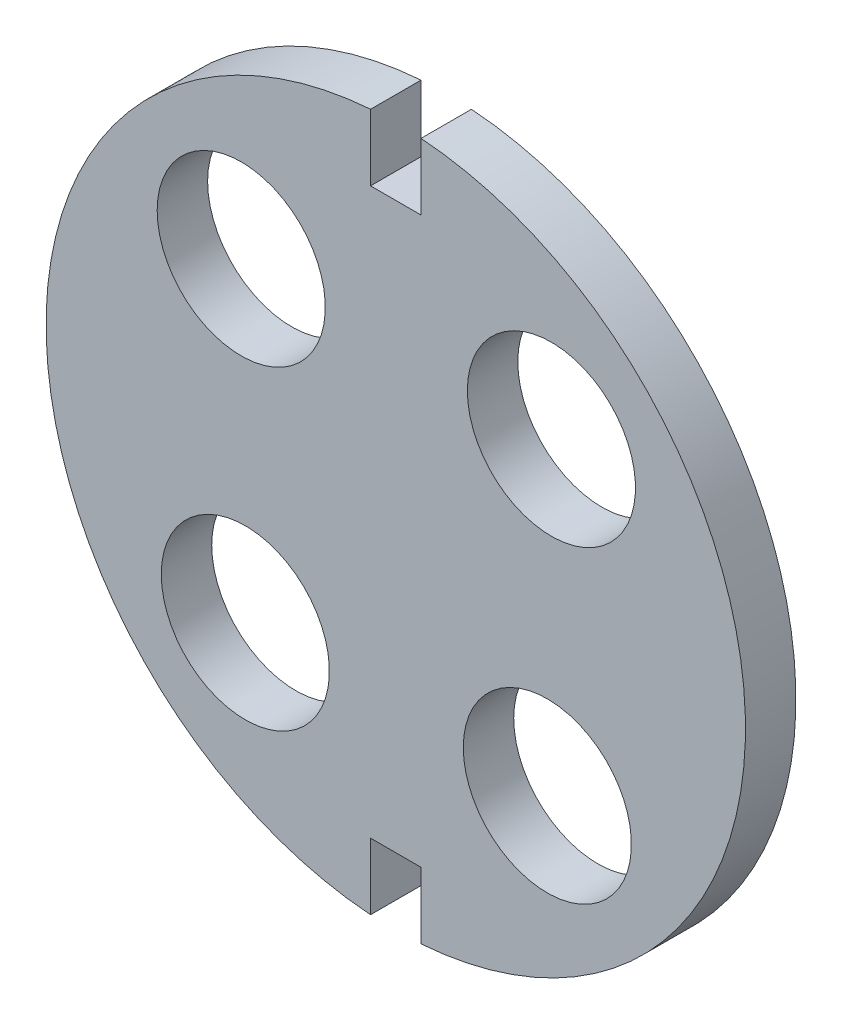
SolidWorks part; units mm, degrees
ref_plane "Front Plane" through (0, 0, 0) normal (0, 0, 1) x (1, 0, 0)
ref_plane "Top Plane" through (0, 0, 0) normal (0, 1, 0) x (1, 0, 0)
ref_plane "Right Plane" through (0, 0, 0) normal (1, 0, 0) x (0, 0, -1)
sketch "Sketch1" plane through (0, 0, 0) normal (0, 0, 1) x (1, 0, 0)
  circle A0 centre (0, 0) radius 26.416
  dimension "D1" = 52.832
extrude "Extrude1" add sketch "Sketch1" along normal blind 3.81
sketch "Sketch2" plane through (0, 0, 0) normal (0, 0, 1) x (1, 0, 0)
  line L0 (0, 0) -> (0, 27.8395) construction
  line L1 (0, 0) -> (0, -28.8472) construction
  line L2 (0, 0) -> (-23.3487, 23.3487) construction
  line L3 (0, 0) -> (-29.645, 0) construction
  line L4 (0, 0) -> (31.2407, 0) construction
  circle A0 centre (-11.6743, 11.6743) radius 6.35
  circle A1 centre (11.7569, 11.5912) radius 6.35
  circle A2 centre (11.4489, -11.8955) radius 6.35
  circle A3 centre (-11.3643, -11.9764) radius 6.35
  dimension "D2" = 12.7
  dimension "D4" = 12.7
  dimension "D5" = 12.7
  dimension "D6" = 12.7
  dimension "D1" = 45
  dimension "D3" = 16.51
  dimension "D7" = 16.51
  dimension "D8" = 16.51
  dimension "D9" = 16.51
extrude "Cut-Extrude1" cut sketch "Sketch2" along normal through all
sketch "Sketch3" plane through (0, 0, 0) normal (0, 0, 1) x (1, 0, 0)
  line L0 (0, 0) -> (0, 27.4196) construction
  line L1 (0, 0) -> (0, -27.9234) construction
  line L2 (-30.4848, 0) -> (29.645, 0) construction
  line L4 (-1.905, 27.4196) -> (1.905, 27.4196)
  line L5 (-1.905, 27.4196) -> (-1.905, 21.336)
  line L6 (-1.905, 21.336) -> (1.905, 21.336)
  line L7 (1.905, 27.4196) -> (1.905, 21.336)
  line L8 (1.905, -27.9234) -> (-1.905, -27.9234)
  line L9 (1.905, -27.9234) -> (1.905, -21.336)
  line L10 (1.905, -21.336) -> (-1.905, -21.336)
  line L11 (-1.905, -27.9234) -> (-1.905, -21.336)
  dimension "D1" = 3.81
  dimension "D2" = 3.81
  dimension "D3" = 1.905
  dimension "D4" = 1.905
  dimension "D5" = 21.336
  dimension "D6" = 21.336
extrude "Cut-Extrude2" cut sketch "Sketch3" along normal through all
